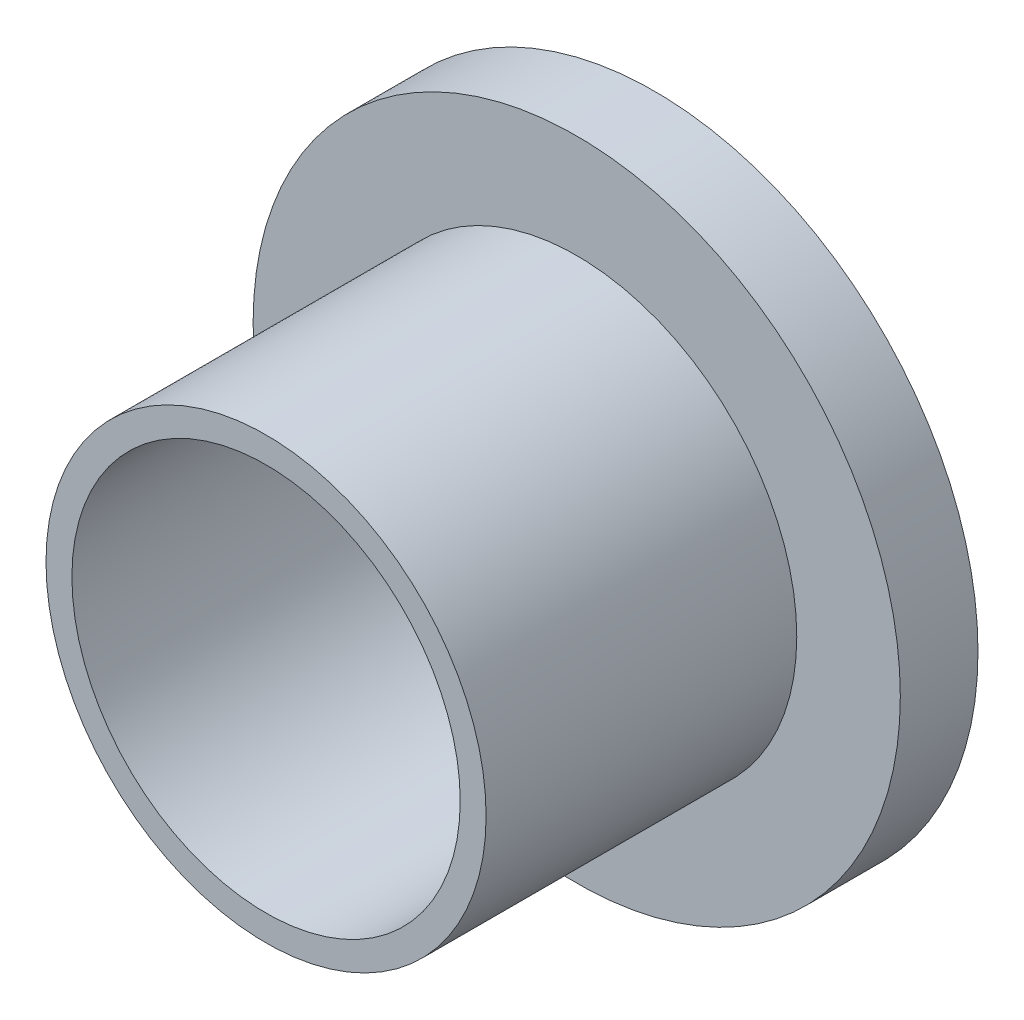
SolidWorks part; units mm, degrees
ref_plane "Front Plane" through (0, 0, 0) normal (0, 0, 1) x (1, 0, 0)
ref_plane "Top Plane" through (0, 0, 0) normal (0, 1, 0) x (1, 0, 0)
ref_plane "Right Plane" through (0, 0, 0) normal (1, 0, 0) x (0, 0, -1)
sketch "Sketch1" plane through (0, 0, 0) normal (0, 0, 1) x (1, 0, 0)
  circle A0 centre (0, 0) radius 8.5
  circle A1 centre (0, 0) radius 7.5
  dimension "D1" = 17
  dimension "D2" = 15
extrude "Boss-Extrude1" add sketch "Sketch1" along normal blind 12
sketch "Sketch2" plane through (0, 0, 0) normal (0, 0, -1) x (-1, 0, 0)
  circle A0 centre (0, 0) radius 12.5
  circle A1 centre (0, 0) radius 7.5
  dimension "D1" = 25
  dimension "D2" = 15
extrude "Boss-Extrude2" add sketch "Sketch2" along normal blind 3
